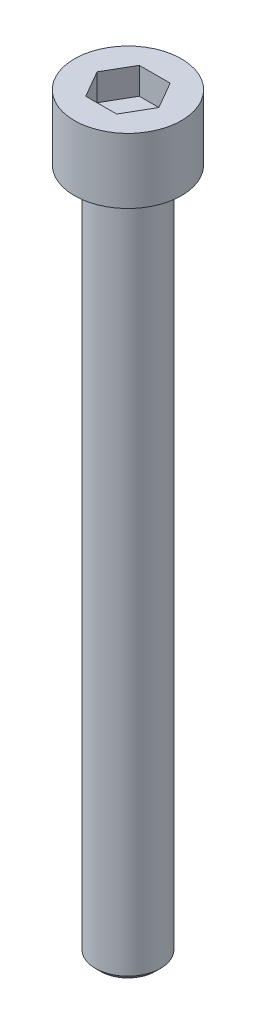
SolidWorks part; units mm, degrees
ref_plane "Front" through (0, 0, 0) normal (0, 0, 1) x (1, 0, 0)
ref_plane "Top" through (0, 0, 0) normal (0, 1, 0) x (1, 0, 0)
ref_plane "Right" through (0, 0, 0) normal (1, 0, 0) x (0, 0, -1)
sketch "Sketch1" plane through (0, 0, 0) normal (0, 0, 1) x (1, 0, 0)
  line L0 (0, 4.826) -> (3.9688, 4.826)
  line L2 (3.9688, 4.826) -> (3.9688, 0)
  line L3 (3.9688, 0) -> (2.413, 0)
  line L4 (2.413, 0) -> (2.413, -50.4031)
  line L5 (2.413, -50.4031) -> (2.0161, -50.8)
  line L6 (2.0161, -50.8) -> (0, -50.8)
  line L7 (0, -50.8) -> (0, 4.826)
  line L8 (0, 17.272) -> (0, -24.892) construction
  dimension "Pitch" = 0.3969
  dimension "D2" = 45
  dimension "Diam" = 4.826
  dimension "Head Dia" = 7.9375
  dimension "Thick" = 4.826
  dimension "Length" = 50.8
revolve "Base-Revolve" add sketch "Sketch1" angle 360 about L8
sketch "Sketch2" plane through (0, 4.826, 0) normal (0, 1, 0) x (-1, 0, 0)
  line L1 (-2.2914, 0) -> (-1.1457, -1.9844)
  line L2 (-1.1457, -1.9844) -> (1.1457, -1.9844)
  line L3 (1.1457, -1.9844) -> (2.2914, 0)
  line L4 (2.2914, 0) -> (1.1457, 1.9844)
  line L5 (1.1457, 1.9844) -> (-1.1457, 1.9844)
  line L6 (-1.1457, 1.9844) -> (-2.2914, 0)
  circle A0 centre (0, 0) radius 1.9844 construction
  dimension "HexK" = 3.9688
extrude "Cut-Extrude1" cut sketch "Sketch2" against normal blind 1.9844
